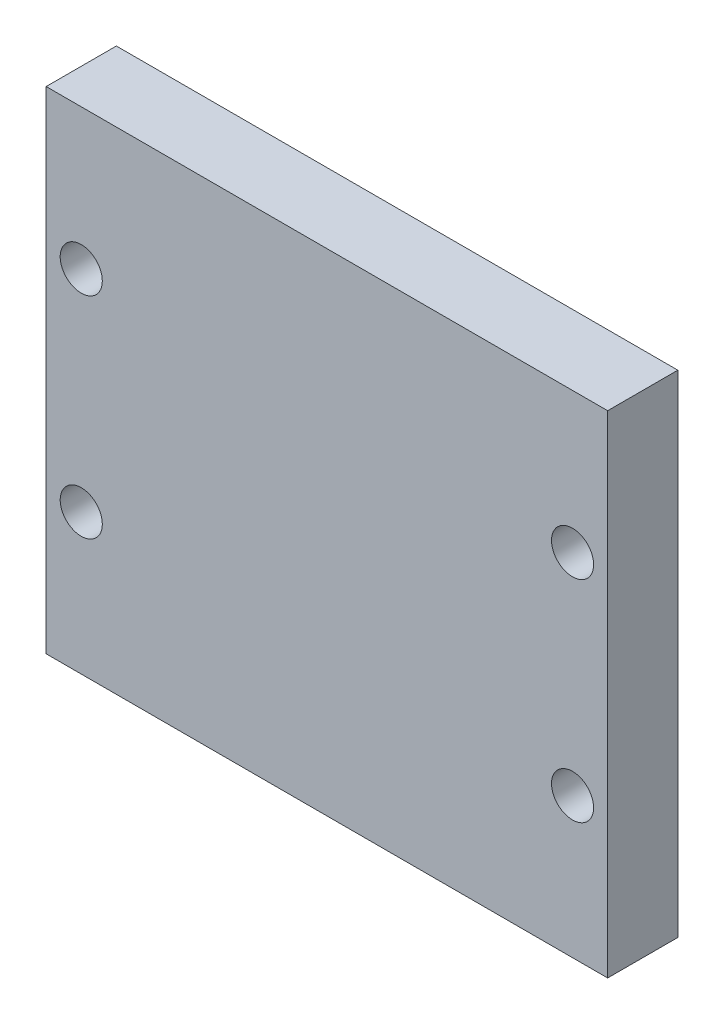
SolidWorks part; units mm, degrees
ref_plane "Front Plane" through (0, 0, 0) normal (0, 0, 1) x (1, 0, 0)
ref_plane "Top Plane" through (0, 0, 0) normal (0, 1, 0) x (1, 0, 0)
ref_plane "Right Plane" through (0, 0, 0) normal (1, 0, 0) x (0, 0, -1)
sketch "Sketch1" plane through (0, 0, 0) normal (0, 0, 1) x (1, 0, 0)
  line L0 (-17.4, -156.0018) -> (-17.4, -191.0018) construction
  line L1 (-19.9, -156.0018) -> (20.1, -156.0018)
  line L2 (-19.9, -156.0018) -> (-19.9, -191.0018)
  line L3 (-19.9, -191.0018) -> (20.1, -191.0018)
  line L4 (20.1, -156.0018) -> (20.1, -191.0018)
  line L5 (17.6, -156.0018) -> (17.6, -191.0018) construction
  circle A0 centre (-17.4, -166.0018) radius 1.5
  circle A1 centre (-17.4, -181.0018) radius 1.5
  circle A2 centre (17.6, -181.0018) radius 1.5
  circle A3 centre (17.6, -166.0018) radius 1.5
  dimension "D7" = 3
  dimension "D8" = 3
  dimension "D9" = 3
  dimension "D10" = 3
  dimension "D1" = 2.5
  dimension "D2" = 2.5
  dimension "D3" = 10
  dimension "D4" = 10
  dimension "D5" = 10
  dimension "D6" = 10
extrude "Boss-Extrude1" add sketch "Sketch1" along normal blind 5
